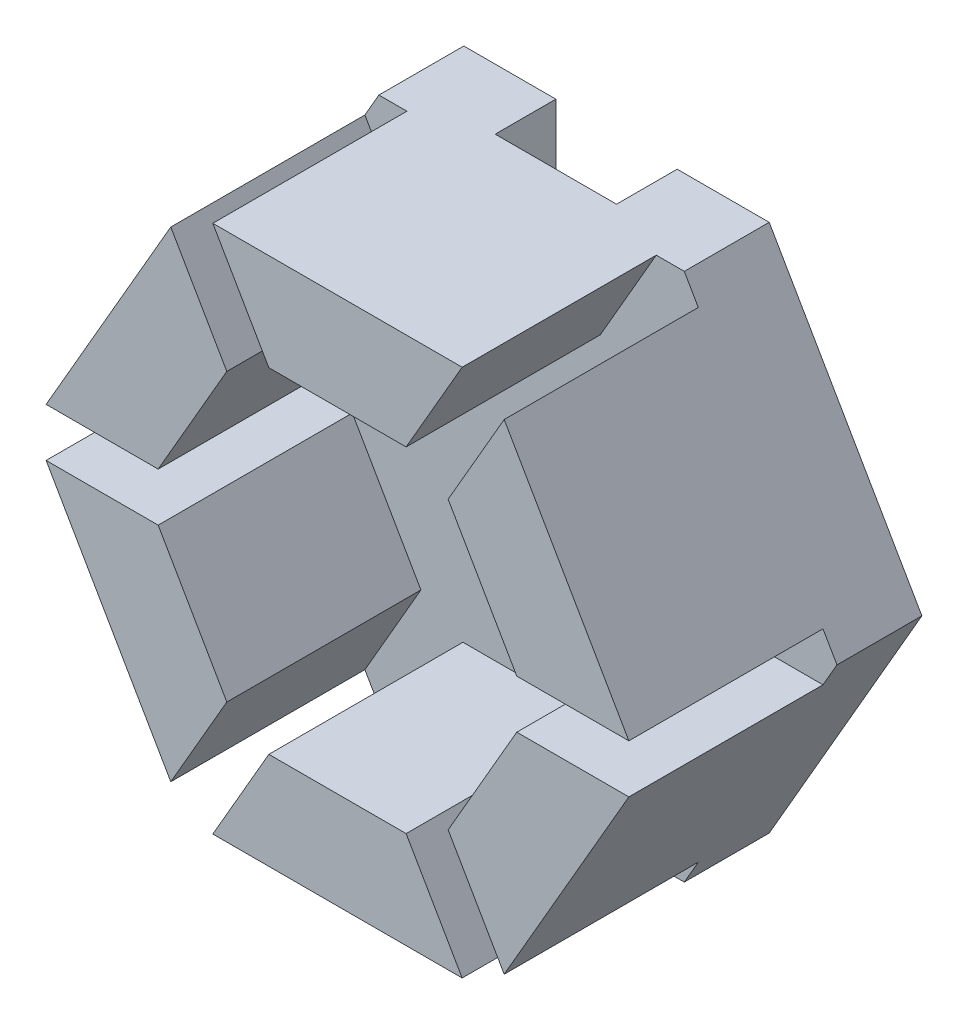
SolidWorks part; units mm, degrees
ref_plane "Plan de face" through (0, 0, 0) normal (0, 0, 1) x (1, 0, 0)
ref_plane "Plan de dessus" through (0, 0, 0) normal (0, 1, 0) x (1, 0, 0)
ref_plane "Plan de droite" through (0, 0, 0) normal (1, 0, 0) x (0, 0, -1)
sketch "Esquisse1" plane through (0, 0, 0) normal (0, 0, 1) x (1, 0, 0)
  line L0 (0, 0) -> (3.9837, 0) construction
  line L1 (3.9837, 0) -> (1.9919, 3.45)
  line L2 (1.9919, 3.45) -> (-1.9919, 3.45)
  line L3 (-1.9919, 3.45) -> (-3.9837, 0)
  line L4 (-3.9837, 0) -> (-1.9919, -3.45)
  line L5 (-1.9919, -3.45) -> (1.9919, -3.45)
  line L6 (1.9919, -3.45) -> (3.9837, 0)
  line L7 (3.1466, 5.45) -> (-3.1466, 5.45)
  line L8 (-3.1466, 5.45) -> (-6.2931, 0)
  line L9 (-6.2931, 0) -> (-3.1466, -5.45)
  line L10 (-3.1466, -5.45) -> (3.1466, -5.45)
  line L11 (3.1466, -5.45) -> (6.2931, 0)
  line L12 (6.2931, 0) -> (3.1466, 5.45)
  circle A0 centre (0, 0) radius 3.45 construction
  dimension "D1" = 6.9
  dimension "D2" = 2
extrude "Boss.-Extru.1" add sketch "Esquisse1" along normal blind 4
sketch "Esquisse2" plane through (0, 0, 0) normal (0, 0, -1) x (-1, 0, 0)
  line L6 (-3.1466, 5.45) -> (-6.2931, 0)
  line L7 (-6.2931, 0) -> (-3.1466, -5.45)
  line L8 (-3.1466, -5.45) -> (3.1466, -5.45)
  line L9 (3.1466, -5.45) -> (6.2931, 0)
  line L10 (6.2931, 0) -> (3.1466, 5.45)
  line L11 (3.1466, 5.45) -> (-3.1466, 5.45)
  line L12 (-3.1466, 5.45) -> (-6.2931, 0)
  line L13 (-6.2931, 0) -> (-3.1466, -5.45)
  line L14 (-3.1466, -5.45) -> (3.1466, -5.45)
  line L15 (3.1466, -5.45) -> (6.2931, 0)
  line L16 (6.2931, 0) -> (3.1466, 5.45)
  line L17 (3.1466, 5.45) -> (-3.1466, 5.45)
  dimension "D1" = 0
extrude "Boss.-Extru.2" add sketch "Esquisse2" along normal blind 1.75
sketch "Esquisse4" plane through (0, 0, -1.75) normal (0, 0, -1) x (-1, 0, 0)
  line L0 (3.1466, 5.45) -> (-3.1466, 5.45) construction
  line L1 (-1.25, 5.45) -> (1.25, 5.45)
  line L2 (-1.25, 5.45) -> (-1.25, -5.45)
  line L3 (-1.25, -5.45) -> (1.25, -5.45)
  line L4 (1.25, 5.45) -> (1.25, -5.45)
  line L5 (-3.1466, -5.45) -> (3.1466, -5.45) construction
  line L6 (0, 0) -> (0, 5.45) construction
  dimension "D1" = 2.5
extrude "Enlèv. mat.-Extru.1" cut sketch "Esquisse4" against normal blind 1.25
sketch "Esquisse5" plane through (0, 0, 4) normal (0, 0, 1) x (1, 0, 0)
  line L0 (-6.0044, 0.5) -> (-3.695, 0.5)
  line L1 (0, 0) -> (-6.2931, 0) construction
  line L2 (-3.1466, 5.45) -> (-6.2931, 0) construction
  line L3 (-1.9919, 3.45) -> (-3.9837, 0) construction
  line L4 (-6.0044, -0.5) -> (-3.695, -0.5)
  line L5 (-6.0044, 0.5) -> (-6.2931, 0)
  line L6 (-6.2931, 0) -> (-6.0044, -0.5)
  line L7 (-3.695, 0.5) -> (-3.9837, 0)
  line L8 (-3.9837, 0) -> (-1.9919, -3.45) construction
  line L9 (-3.9837, 0) -> (-3.695, -0.5)
  line L10 (-2.5692, 5.45) -> (-1.4145, 3.45)
  line L11 (-3.4352, 4.95) -> (-2.2805, 2.95)
  line L12 (-2.5692, 5.45) -> (-3.1466, 5.45)
  line L13 (-3.1466, 5.45) -> (-3.4352, 4.95)
  line L14 (-1.4145, 3.45) -> (-1.9919, 3.45)
  line L15 (-1.9919, 3.45) -> (-2.2805, 2.95)
  line L16 (3.4352, 4.95) -> (2.2805, 2.95)
  line L17 (2.5692, 5.45) -> (1.4145, 3.45)
  line L18 (3.4352, 4.95) -> (3.1466, 5.45)
  line L19 (3.1466, 5.45) -> (2.5692, 5.45)
  line L20 (2.2805, 2.95) -> (1.9919, 3.45)
  line L21 (1.9919, 3.45) -> (1.4145, 3.45)
  line L22 (6.0044, -0.5) -> (3.695, -0.5)
  line L23 (6.0044, 0.5) -> (3.695, 0.5)
  line L24 (6.0044, -0.5) -> (6.2931, 0)
  line L25 (6.2931, 0) -> (6.0044, 0.5)
  line L26 (3.695, -0.5) -> (3.9837, 0)
  line L27 (3.9837, 0) -> (3.695, 0.5)
  line L28 (2.5692, -5.45) -> (1.4145, -3.45)
  line L29 (3.4352, -4.95) -> (2.2805, -2.95)
  line L30 (2.5692, -5.45) -> (3.1466, -5.45)
  line L31 (3.1466, -5.45) -> (3.4352, -4.95)
  line L32 (1.4145, -3.45) -> (1.9919, -3.45)
  line L33 (1.9919, -3.45) -> (2.2805, -2.95)
  line L34 (-3.4352, -4.95) -> (-2.2805, -2.95)
  line L35 (-2.5692, -5.45) -> (-1.4145, -3.45)
  line L36 (-3.4352, -4.95) -> (-3.1466, -5.45)
  line L37 (-3.1466, -5.45) -> (-2.5692, -5.45)
  line L38 (-2.2805, -2.95) -> (-1.9919, -3.45)
  line L39 (-1.9919, -3.45) -> (-1.4145, -3.45)
  point P29 (0, 0)
  dimension "D1" = 1
  dimension "D2" = 6
extrude "Enlèv. mat.-Extru.2" cut sketch "Esquisse5" against normal up to vertex (4 mm away)
